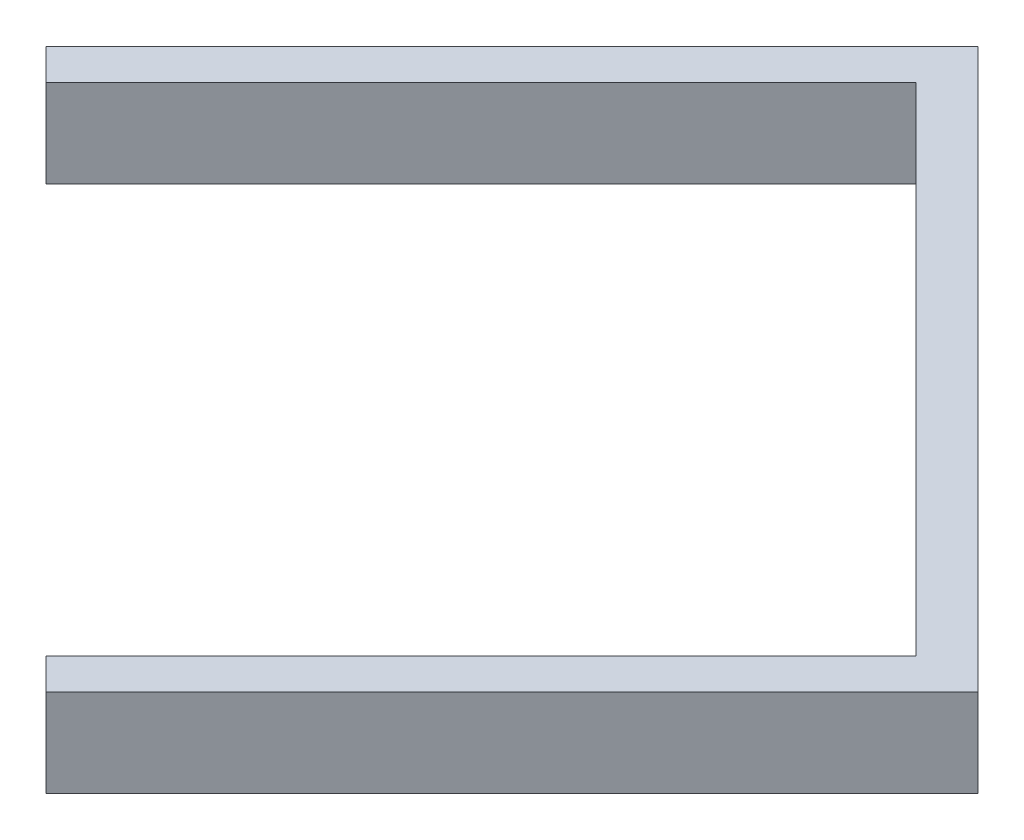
SolidWorks part; units mm, degrees
ref_plane "Front Plane" through (0, 0, 0) normal (0, 0, 1) x (1, 0, 0)
ref_plane "Top Plane" through (0, 0, 0) normal (0, 1, 0) x (1, 0, 0)
ref_plane "Right Plane" through (0, 0, 0) normal (1, 0, 0) x (0, 0, -1)
sketch "Sketch2" plane through (0, 0, 0) normal (0, 1, 0) x (1, 0, 0)
  line L0 (-311.9853, 47.8058) -> (-329.9458, 65.7663)
  line L1 (-329.9458, 65.7663) -> (-60.5382, 335.174)
  line L2 (-60.5382, 335.174) -> (262.7511, 11.8848)
  line L3 (262.7511, 11.8848) -> (-6.6566, -257.5229)
  line L4 (-6.6566, -257.5229) -> (-24.6171, -239.5624)
  line L5 (-24.6171, -239.5624) -> (226.83, 11.8848)
  line L6 (226.83, 11.8848) -> (-60.5382, 299.253)
  line L7 (-60.5382, 299.253) -> (-311.9853, 47.8058)
  line L8 (-154.8004, -82.3774) -> (83.1459, 155.5689)
  point P10 (83.1459, 155.5689)
  dimension "D1" = 25.4
  dimension "D2" = 25.4
  dimension "D3" = 406.4
  dimension "D4" = 355.6
extrude "Boss-Extrude2" add sketch "Sketch2" along normal blind 50.8 contours L7 L6 L5 L4 L3 L2 L1 L0
sketch "Sketch3" plane through (137.3179, 0, -137.3179) normal (0.7071, 0, -0.7071) x (-0.7071, 0, -0.7071)
  line L0 (279.8108, 50.8) -> (279.8108, 0) construction
  circle A0 centre (0, 25.4) radius 6.35
  point P5 (279.8108, 25.4)
  dimension "D1" = 12.7
extrude "Cut-Extrude1" cut sketch "Sketch3" against normal blind 50.8
